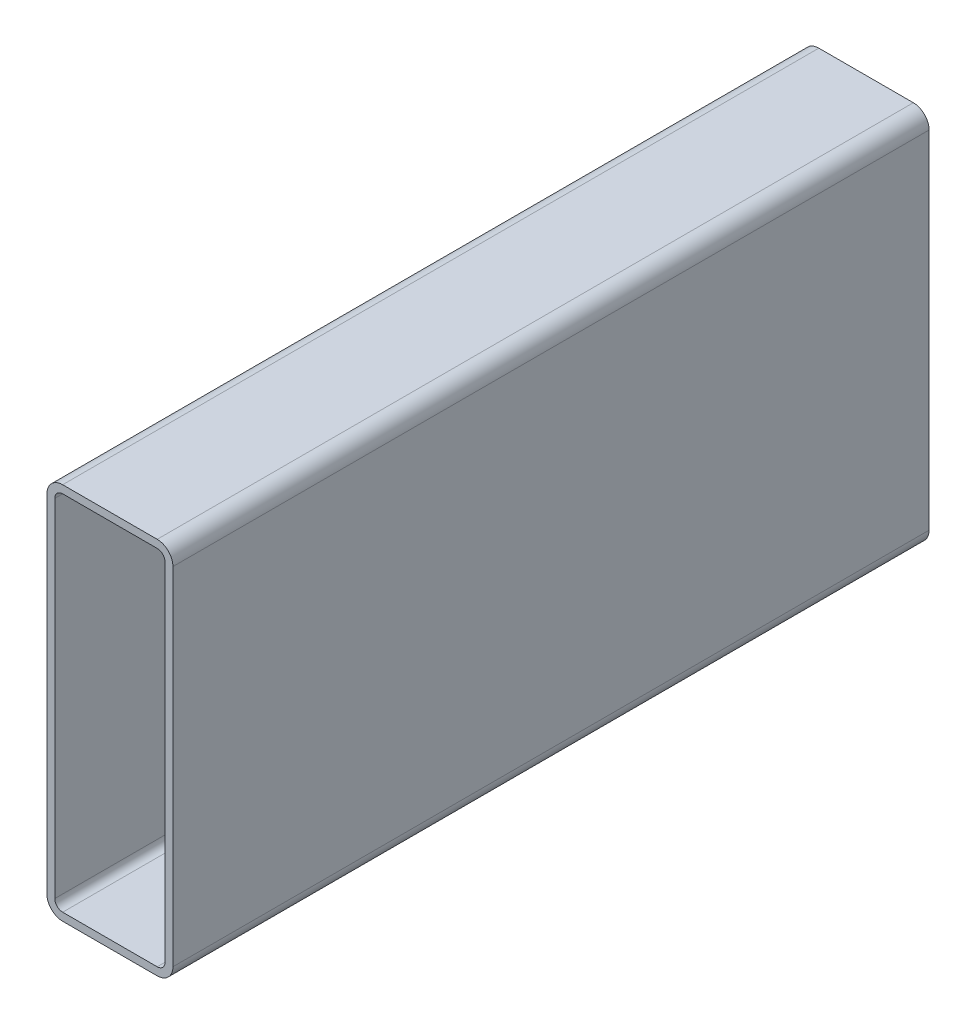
SolidWorks part; units mm, degrees
ref_plane "Front Plane" through (0, 0, 0) normal (0, 0, 1) x (1, 0, 0)
ref_plane "Top Plane" through (0, 0, 0) normal (0, 1, 0) x (1, 0, 0)
ref_plane "Right Plane" through (0, 0, 0) normal (1, 0, 0) x (0, 0, -1)
sketch "Sketch1" plane through (0, 0, 0) normal (0, 0, 1) x (1, 0, 0)
  line B0 (6.35, 152.4) -> (44.45, 152.4)
  arc B1 (50.8, 146.05) -> (44.45, 152.4) centre (44.45, 146.05) ccw
  line B2 (50.8, 146.05) -> (50.8, 6.35)
  arc B3 (44.45, 0) -> (50.8, 6.35) centre (44.45, 6.35) ccw
  line B4 (44.45, 0) -> (6.35, 0)
  arc B5 (0, 6.35) -> (6.35, 0) centre (6.35, 6.35) ccw
  line B6 (0, 6.35) -> (0, 146.05)
  arc B7 (6.35, 152.4) -> (0, 146.05) centre (6.35, 146.05) ccw
  line B8 (6.35, 149.225) -> (44.45, 149.225)
  arc B9 (47.625, 146.05) -> (44.45, 149.225) centre (44.45, 146.05) ccw
  line B10 (47.625, 146.05) -> (47.625, 6.35)
  arc B11 (44.45, 3.175) -> (47.625, 6.35) centre (44.45, 6.35) ccw
  line B12 (44.45, 3.175) -> (6.35, 3.175)
  arc B13 (3.175, 6.35) -> (6.35, 3.175) centre (6.35, 6.35) ccw
  line B14 (3.175, 6.35) -> (3.175, 146.05)
  arc B15 (6.35, 149.225) -> (3.175, 146.05) centre (6.35, 146.05) ccw
sketch_block_instance "HSS6x2x0.125-1"
sketch_block "HSS6x2x0.125"
extrude "Boss-Extrude1" add sketch "Sketch1" along normal blind 304.8
